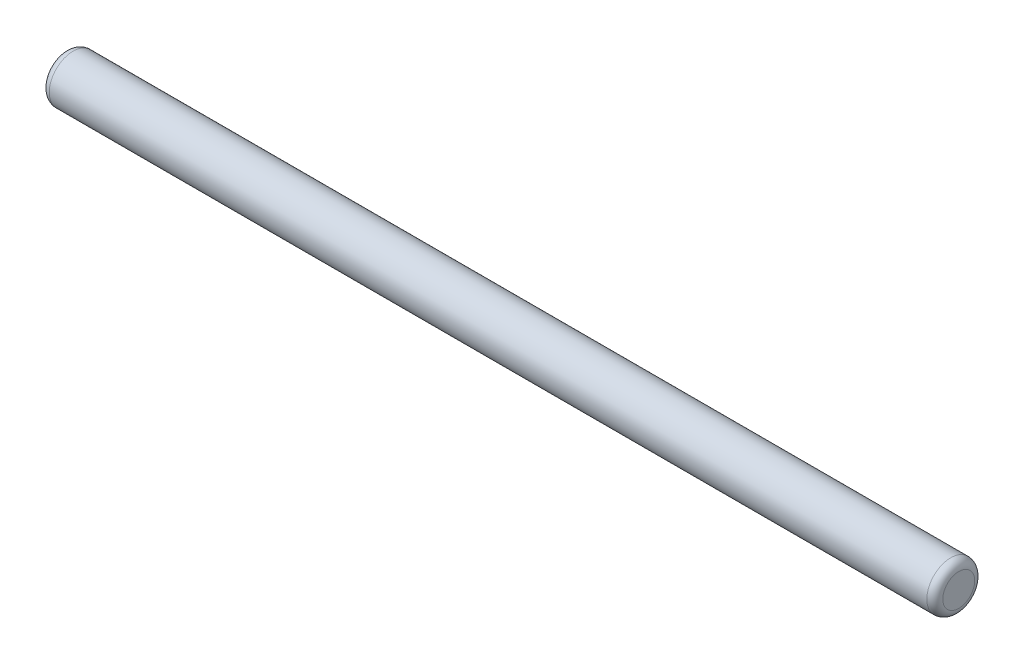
SolidWorks part; units mm, degrees
ref_plane "Front Plane" through (0, 0, 0) normal (0, 0, 1) x (1, 0, 0)
ref_plane "Top Plane" through (0, 0, 0) normal (0, 1, 0) x (1, 0, 0)
ref_plane "Right Plane" through (0, 0, 0) normal (1, 0, 0) x (0, 0, -1)
sketch "Sketch1" plane through (0, 0, 0) normal (1, 0, 0) x (0, 0, -1)
  circle A0 centre (0, 0) radius 4.7625
  dimension "D1" = 9.525
extrude "Boss-Extrude1" add sketch "Sketch1" along normal blind 177.8
fillet "Fillet1" radius 1.5875 2 edges at (0, 0, -4.7625) (177.8, 0, -4.7625)
